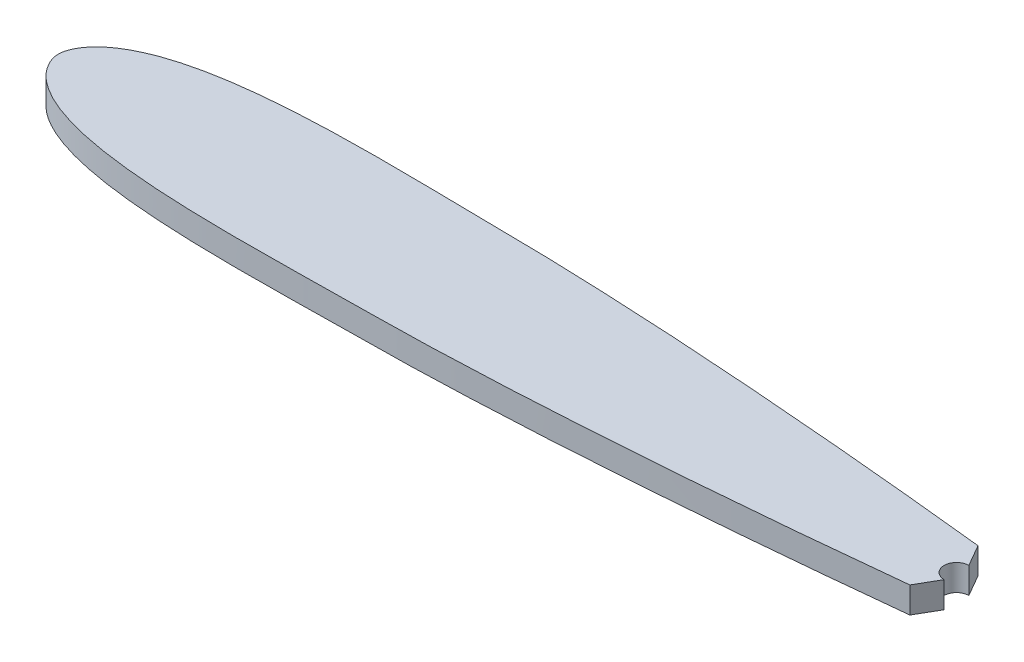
SolidWorks part; units mm, degrees
ref_plane "Front Plane" through (0, 0, 0) normal (0, 0, 1) x (1, 0, 0)
ref_plane "Top Plane" through (0, 0, 0) normal (0, 1, 0) x (1, 0, 0)
ref_plane "Right Plane" through (0, 0, 0) normal (1, 0, 0) x (0, 0, -1)
sketch "Sketch1" plane through (0, 0, 0) normal (0, 1, 0) x (1, 0, 0)
  line L0 (67.779, 0.1312) -> (67.7979, 0.1196)
  spline S0 degree 3 poles (67.779, 0.1312) (65.037, 0.509) (59.9653, 1.2133) (52.5545, 2.1584) (45.5544, 3.0065) (36.2239, 4.0688) (26.8903, 5.0418) (17.554, 5.9194) (10.5538, 6.5213) (3.5539, 7.068) (-3.4928, 7.5501) (-10.5393, 7.9627) (-17.5866, 8.2682) (-24.587, 8.4939) (-30.3757, 8.4899) (-34.995, 8.5975) (-40.7818, 8.6781) (-47.7881, 8.6816) (-54.7938, 8.3117) (-59.2263, 7.8182) (-62.2657, 7.3199) (-64.6009, 6.7884) (-66.462, 6.2257) (-67.8707, 5.7109) (-69.2876, 5.0653) (-70.7297, 4.2194) (-71.9259, 3.2301) (-72.9794, 1.9059) (-73.7548, 0.1241) (-72.9794, -1.6577) (-71.9259, -2.9819) (-70.7297, -3.9712) (-69.2876, -4.8171) (-67.8707, -5.4627) (-66.462, -5.9775) (-64.6009, -6.5402) (-62.2657, -7.0717) (-59.2263, -7.57) (-54.7938, -8.0635) (-47.7881, -8.4334) (-40.7818, -8.4299) (-34.995, -8.3493) (-30.3757, -8.2417) (-24.587, -8.2457) (-17.5866, -8.02) (-10.5393, -7.7145) (-3.4928, -7.3019) (3.5539, -6.8198) (10.5538, -6.2731) (17.554, -5.6712) (26.8903, -4.7936) (36.2239, -3.8206) (45.5544, -2.7583) (52.5545, -1.9102) (59.9716, -0.9642) (65.0496, -0.2591) (67.7979, 0.1196) knots -0.004321 -0.004321 -0.004321 -0.004321 0.024634 0.049243 0.07383 0.098397 0.147479 0.171995 0.196494 0.220976 0.245442 0.27038 0.294813 0.319232 0.343642 0.35536 0.367566 0.404183 0.428636 0.44092 0.450818 0.460843 0.465946 0.471149 0.476523 0.482208 0.488618 0.492568 0.5 0.507432 0.511382 0.517792 0.523477 0.528851 0.534054 0.539157 0.549182 0.55908 0.571364 0.595817 0.632434 0.64464 0.656358 0.680768 0.705187 0.72962 0.754558 0.779024 0.803506 0.828005 0.852521 0.901603 0.92617 0.950757 0.975366 1.004387 1.004387 1.004387 1.004387
  point P2 (67.779, 0.1312)
extrude "Boss-Extrude1" add sketch "Sketch1" along normal blind 3.175
sketch "Sketch2" plane through (0, 3.175, 0) normal (0, 1, 0) x (1, 0, 0)
  line L0 (67.779, 0.1312) -> (-73.4485, 0.1312) construction
  circle A0 centre (35.779, 0.1312) radius 1.5
  spline S0 degree 3 poles (67.779, 0.1312) (65.037, 0.509) (59.9653, 1.2133) (52.5545, 2.1584) (45.5544, 3.0065) (36.2239, 4.0688) (26.8903, 5.0418) (17.554, 5.9194) (10.5538, 6.5213) (3.5539, 7.068) (-3.4928, 7.5501) (-10.5393, 7.9627) (-17.5866, 8.2682) (-24.587, 8.4939) (-30.3757, 8.4899) (-34.995, 8.5975) (-40.7818, 8.6781) (-47.7881, 8.6816) (-54.7938, 8.3117) (-59.2263, 7.8182) (-62.2657, 7.3199) (-64.6009, 6.7884) (-66.462, 6.2257) (-67.8707, 5.7109) (-69.2876, 5.0653) (-70.7297, 4.2194) (-71.9259, 3.2301) (-72.9794, 1.9059) (-73.7548, 0.1241) (-72.9794, -1.6577) (-71.9259, -2.9819) (-70.7297, -3.9712) (-69.2876, -4.8171) (-67.8707, -5.4627) (-66.462, -5.9775) (-64.6009, -6.5402) (-62.2657, -7.0717) (-59.2263, -7.57) (-54.7938, -8.0635) (-47.7881, -8.4334) (-40.7818, -8.4299) (-34.995, -8.3493) (-30.3757, -8.2417) (-24.587, -8.2457) (-17.5866, -8.02) (-10.5393, -7.7145) (-3.4928, -7.3019) (3.5539, -6.8198) (10.5538, -6.2731) (17.554, -5.6712) (26.8903, -4.7936) (36.2239, -3.8206) (45.5544, -2.7583) (52.5545, -1.9102) (59.9716, -0.9642) (65.0496, -0.2591) (67.7979, 0.1196) knots -0.004321 -0.004321 -0.004321 -0.004321 0.024634 0.049243 0.07383 0.098397 0.147479 0.171995 0.196494 0.220976 0.245442 0.27038 0.294813 0.319232 0.343642 0.35536 0.367566 0.404183 0.428636 0.44092 0.450818 0.460843 0.465946 0.471149 0.476523 0.482208 0.488618 0.492568 0.5 0.507432 0.511382 0.517792 0.523477 0.528851 0.534054 0.539157 0.549182 0.55908 0.571364 0.595817 0.632434 0.64464 0.656358 0.680768 0.705187 0.72962 0.754558 0.779024 0.803506 0.828005 0.852521 0.901603 0.92617 0.950757 0.975366 1.004387 1.004387 1.004387 1.004387 construction
  dimension "D1" = 3
  dimension "D2" = 32
extrude "Cut-Extrude1" cut sketch "Sketch2" against normal blind 3.175
sketch "Sketch3" plane through (0, 0, 0) normal (0, -1, 0) x (1, 0, 0)
  line L0 (67.7979, -0.1196) -> (-73.4485, -0.1196) construction
  circle A0 centre (-52.1985, -0.1196) radius 1.5
  spline S0 degree 3 poles (67.779, -0.1312) (65.037, -0.509) (59.9653, -1.2133) (52.5545, -2.1584) (45.5544, -3.0065) (36.2239, -4.0688) (26.8903, -5.0418) (17.554, -5.9194) (10.5538, -6.5213) (3.5539, -7.068) (-3.4928, -7.5501) (-10.5393, -7.9627) (-17.5866, -8.2682) (-24.587, -8.4939) (-30.3757, -8.4899) (-34.995, -8.5975) (-40.7818, -8.6781) (-47.7881, -8.6816) (-54.7938, -8.3117) (-59.2263, -7.8182) (-62.2657, -7.3199) (-64.6009, -6.7884) (-66.462, -6.2257) (-67.8707, -5.7109) (-69.2876, -5.0653) (-70.7297, -4.2194) (-71.9259, -3.2301) (-72.9794, -1.9059) (-73.7548, -0.1241) (-72.9794, 1.6577) (-71.9259, 2.9819) (-70.7297, 3.9712) (-69.2876, 4.8171) (-67.8707, 5.4627) (-66.462, 5.9775) (-64.6009, 6.5402) (-62.2657, 7.0717) (-59.2263, 7.57) (-54.7938, 8.0635) (-47.7881, 8.4334) (-40.7818, 8.4299) (-34.995, 8.3493) (-30.3757, 8.2417) (-24.587, 8.2457) (-17.5866, 8.02) (-10.5393, 7.7145) (-3.4928, 7.3019) (3.5539, 6.8198) (10.5538, 6.2731) (17.554, 5.6712) (26.8903, 4.7936) (36.2239, 3.8206) (45.5544, 2.7583) (52.5545, 1.9102) (59.9716, 0.9642) (65.0496, 0.2591) (67.7979, -0.1196) knots -0.004321 -0.004321 -0.004321 -0.004321 0.024634 0.049243 0.07383 0.098397 0.147479 0.171995 0.196494 0.220976 0.245442 0.27038 0.294813 0.319232 0.343642 0.35536 0.367566 0.404183 0.428636 0.44092 0.450818 0.460843 0.465946 0.471149 0.476523 0.482208 0.488618 0.492568 0.5 0.507432 0.511382 0.517792 0.523477 0.528851 0.534054 0.539157 0.549182 0.55908 0.571364 0.595817 0.632434 0.64464 0.656358 0.680768 0.705187 0.72962 0.754558 0.779024 0.803506 0.828005 0.852521 0.901603 0.92617 0.950757 0.975366 1.004387 1.004387 1.004387 1.004387 construction
  dimension "D2" = 3
  dimension "D1" = 21.25
extrude "Cut-Extrude2" cut sketch "Sketch3" against normal blind 1.5875
sketch "Sketch4" plane through (0, 3.175, 0) normal (0, 1, 0) x (1, 0, 0)
  line L0 (35.779, 4.0996) -> (35.779, 1.6312)
  line L1 (35.779, -1.3688) -> (35.779, -3.8514)
  line L2 (67.7979, 0.1196) -> (67.779, 0.1312)
  line L3 (67.7979, 0.1196) -> (67.779, 0.1312)
  circle A1 centre (35.779, 0.1312) radius 1.5
  arc A2 (35.779, -1.3688) -> (35.779, 1.6312) centre (35.779, 0.1312) ccw
  spline S0 degree 3 poles (67.779, 0.1312) (65.037, 0.509) (59.9653, 1.2133) (52.5545, 2.1584) (45.5544, 3.0065) (36.2239, 4.0688) (26.8903, 5.0418) (17.554, 5.9194) (10.5538, 6.5213) (3.5539, 7.068) (-3.4928, 7.5501) (-10.5393, 7.9627) (-17.5866, 8.2682) (-24.587, 8.4939) (-30.3757, 8.4899) (-34.995, 8.5975) (-40.7818, 8.6781) (-47.7881, 8.6816) (-54.7938, 8.3117) (-59.2263, 7.8182) (-62.2657, 7.3199) (-64.6009, 6.7884) (-66.462, 6.2257) (-67.8707, 5.7109) (-69.2876, 5.0653) (-70.7297, 4.2194) (-71.9259, 3.2301) (-72.9794, 1.9059) (-73.7548, 0.1241) (-72.9794, -1.6577) (-71.9259, -2.9819) (-70.7297, -3.9712) (-69.2876, -4.8171) (-67.8707, -5.4627) (-66.462, -5.9775) (-64.6009, -6.5402) (-62.2657, -7.0717) (-59.2263, -7.57) (-54.7938, -8.0635) (-47.7881, -8.4334) (-40.7818, -8.4299) (-34.995, -8.3493) (-30.3757, -8.2417) (-24.587, -8.2457) (-17.5866, -8.02) (-10.5393, -7.7145) (-3.4928, -7.3019) (3.5539, -6.8198) (10.5538, -6.2731) (17.554, -5.6712) (26.8903, -4.7936) (36.2239, -3.8206) (45.5544, -2.7583) (52.5545, -1.9102) (59.9716, -0.9642) (65.0496, -0.2591) (67.7979, 0.1196) knots -0.004321 -0.004321 -0.004321 -0.004321 0.024634 0.049243 0.07383 0.098397 0.147479 0.171995 0.196494 0.220976 0.245442 0.27038 0.294813 0.319232 0.343642 0.35536 0.367566 0.404183 0.428636 0.44092 0.450818 0.460843 0.465946 0.471149 0.476523 0.482208 0.488618 0.492568 0.5 0.507432 0.511382 0.517792 0.523477 0.528851 0.534054 0.539157 0.549182 0.55908 0.571364 0.595817 0.632434 0.64464 0.656358 0.680768 0.705187 0.72962 0.754558 0.779024 0.803506 0.828005 0.852521 0.901603 0.92617 0.950757 0.975366 1.004387 1.004387 1.004387 1.004387 construction
  spline S1 degree 3 poles (35.779, -3.8514) (36.7033, -3.7515) (39.962, -3.395) (45.5544, -2.7583) (52.5545, -1.9102) (59.9716, -0.9642) (65.0496, -0.2591) (67.7979, 0.1196) knots 0.891878 0.891878 0.891878 0.891878 0.901603 0.92617 0.950757 0.975366 1.004387 1.004387 1.004387 1.004387
  spline S2 degree 3 poles (1569.4467, 6806.5053) (441.5587, -135.6767) (254.0186, -23.535) (52.5545, 2.1584) (45.5544, 3.0065) (36.2239, 4.0688) (26.8903, 5.0418) (17.554, 5.9194) (10.5538, 6.5213) (3.5539, 7.068) (-3.4928, 7.5501) (-10.5393, 7.9627) (-17.5866, 8.2682) (-24.587, 8.4939) (-30.3757, 8.4899) (-34.995, 8.5975) (-40.7818, 8.6781) (-47.7881, 8.6816) (-54.7938, 8.3117) (-59.2263, 7.8182) (-62.2657, 7.3199) (-64.6009, 6.7884) (-66.462, 6.2257) (-67.8707, 5.7109) (-69.2876, 5.0653) (-70.7297, 4.2194) (-71.9259, 3.2301) (-72.9794, 1.9059) (-73.7548, 0.1241) (-72.9794, -1.6577) (-71.9259, -2.9819) (-70.7297, -3.9712) (-69.2876, -4.8171) (-67.8707, -5.4627) (-66.462, -5.9775) (-64.6009, -6.5402) (-62.2657, -7.0717) (-59.2263, -7.57) (-54.7938, -8.0635) (-47.7881, -8.4334) (-40.7818, -8.4299) (-34.995, -8.3493) (-30.3757, -8.2417) (-24.587, -8.2457) (-17.5866, -8.02) (-10.5393, -7.7145) (-3.4928, -7.3019) (3.5539, -6.8198) (10.5538, -6.2731) (17.554, -5.6712) (26.8903, -4.7936) (36.2239, -3.8206) (45.5544, -2.7583) (52.5545, -1.9102) (254.0152, 23.7828) (441.5524, 135.9211) (1569.3893, -6805.9044) knots -2.050714 -2.050714 -2.050714 -2.050714 0.024634 0.049243 0.07383 0.098397 0.147479 0.171995 0.196494 0.220976 0.245442 0.27038 0.294813 0.319232 0.343642 0.35536 0.367566 0.404183 0.428636 0.44092 0.450818 0.460843 0.465946 0.471149 0.476523 0.482208 0.488618 0.492568 0.5 0.507432 0.511382 0.517792 0.523477 0.528851 0.534054 0.539157 0.549182 0.55908 0.571364 0.595817 0.632434 0.64464 0.656358 0.680768 0.705187 0.72962 0.754558 0.779024 0.803506 0.828005 0.852521 0.901603 0.92617 0.950757 0.975366 3.050678 3.050678 3.050678 3.050678 only from (67.779, 0.1312) to (67.7979, 0.1196)
  spline S3 degree 3 poles (67.779, 0.1312) (65.037, 0.509) (59.9653, 1.2133) (52.5545, 2.1584) (45.5544, 3.0065) (39.962, 3.6432) (36.7033, 3.9997) (35.779, 4.0996) knots -0.004321 -0.004321 -0.004321 -0.004321 0.024634 0.049243 0.07383 0.098397 0.108122 0.108122 0.108122 0.108122
  dimension "D1" = 0
  dimension "D2" = 0
extrude "Cut-Extrude3" cut sketch "Sketch4" against normal through all both and the other way through all
sketch "Sketch5" plane through (0, 3.175, 0) normal (0, 1, 0) x (1, 0, 0)
  line L0 (35.779, 1.6312) -> (34.2597, 4.2628)
  line L1 (35.779, -1.3688) -> (34.2509, -4.0155)
  line L2 (35.779, -3.8514) -> (35.779, -1.3688)
  line L3 (35.779, 1.6312) -> (35.779, 4.0996)
  line L4 (35.779, -3.8514) -> (35.779, -1.3688)
  line L5 (35.779, 1.6312) -> (35.779, 4.0996)
  arc A3 (35.779, 1.6312) -> (35.779, -1.3688) centre (35.779, 0.1312) ccw
  spline S0 degree 3 poles (34.2509, -4.0155) (34.7603, -3.9612) (35.2697, -3.9065) (35.779, -3.8514) knots 0.886519 0.886519 0.886519 0.886519 0.891878 0.891878 0.891878 0.891878
  spline S1 degree 3 poles (1342.8129, 6290.9494) (1461.1638, -978.196) (781.6702, -65.9055) (17.5537, 5.9195) (10.5534, 6.5214) (3.5534, 7.0681) (-3.4934, 7.5503) (-10.54, 7.9628) (-17.5874, 8.2683) (-24.5879, 8.494) (-30.3767, 8.4901) (-34.996, 8.5976) (-40.7829, 8.6782) (-47.7894, 8.6818) (-54.7951, 8.3118) (-59.2277, 7.8184) (-62.2671, 7.32) (-64.6024, 6.7885) (-66.4636, 6.2258) (-67.8723, 5.711) (-69.2892, 5.0654) (-70.7313, 4.2194) (-71.9275, 3.2301) (-72.981, 1.9059) (-73.7565, 0.1241) (-72.981, -1.6577) (-71.9275, -2.9819) (-70.7313, -3.9712) (-69.2892, -4.8172) (-67.8723, -5.4628) (-66.4636, -5.9776) (-64.6024, -6.5403) (-62.2671, -7.0718) (-59.2277, -7.5701) (-54.7951, -8.0636) (-47.7894, -8.4336) (-40.7829, -8.43) (-34.996, -8.3494) (-30.3767, -8.2419) (-24.5879, -8.2458) (-17.5874, -8.0201) (-10.54, -7.7146) (-3.4934, -7.302) (3.5534, -6.8199) (10.5534, -6.2732) (17.5537, -5.6713) (781.6754, 66.1542) (1461.173, 978.4565) (1342.8104, -6290.8491) knots -7.831927 -7.831927 -7.831927 -7.831927 0.147479 0.171995 0.196494 0.220976 0.245442 0.27038 0.294813 0.319232 0.343642 0.35536 0.367566 0.404183 0.428636 0.44092 0.450818 0.460843 0.465946 0.471149 0.476523 0.482208 0.488618 0.492568 0.5 0.507432 0.511382 0.517792 0.523477 0.528851 0.534054 0.539157 0.549182 0.55908 0.571364 0.595817 0.632434 0.64464 0.656358 0.680768 0.705187 0.72962 0.754558 0.779024 0.803506 0.828005 0.852521 8.831981 8.831981 8.831981 8.831981 only from (35.779, 4.0996) to (35.779, -3.8514)
  spline S2 degree 3 poles (35.779, 4.0996) (35.2726, 4.1544) (34.7662, 4.2088) (34.2597, 4.2628) knots 0.108122 0.108122 0.108122 0.108122 0.11345 0.11345 0.11345 0.11345
  dimension "D2" = 30
  dimension "D3" = 30
  dimension "D1" = 0
extrude "Cut-Extrude4" cut sketch "Sketch5" against normal through all both and the other way through all
